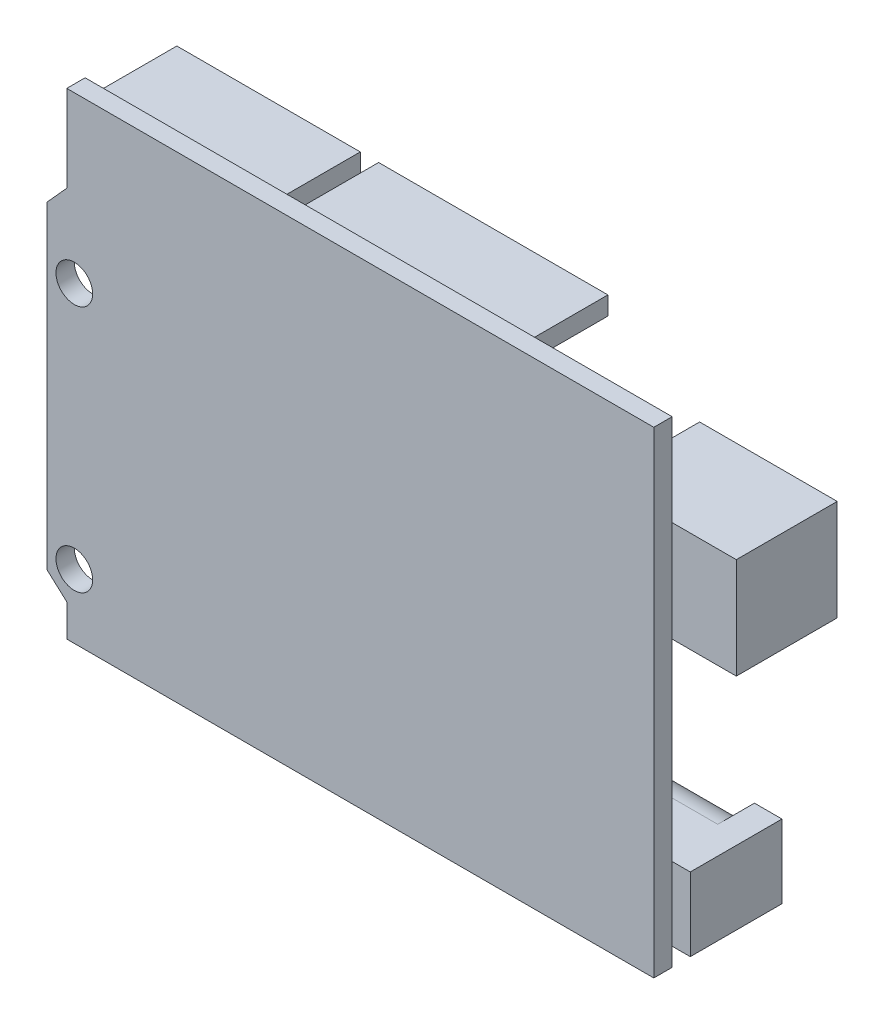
SolidWorks part; units mm, degrees
ref_plane "Plan de face" through (0, 0, 0) normal (0, 0, 1) x (1, 0, 0)
ref_plane "Plan de dessus" through (0, 0, 0) normal (0, 1, 0) x (1, 0, 0)
ref_plane "Plan de droite" through (0, 0, 0) normal (1, 0, 0) x (0, 0, -1)
sketch "Esquisse1" plane through (0, 0, 0) normal (0, 0, 1) x (1, 0, 0)
  line L1 (0, 0) -> (64, 0)
  line L2 (0, 0) -> (0, -52)
  line L3 (0, -52) -> (64, -52)
  line L4 (64, 0) -> (64, -52)
  dimension "D1" = 64
  dimension "D2" = 52
extrude "Boss.-Extru.1" add sketch "Esquisse1" along normal blind 2
sketch "Esquisse2" plane through (0, 0, 0) normal (0, 0, -1) x (-1, 0, 0)
  line L0 (-64, -52) -> (-64, 0) construction
  line L1 (-70.998, -10) -> (-55.998, -10)
  line L2 (-70.998, -10) -> (-70.998, -21)
  line L3 (-70.998, -21) -> (-55.998, -21)
  line L4 (-55.998, -10) -> (-55.998, -21)
  line L5 (-64, 0) -> (0, 0) construction
  dimension "D1" = 15
  dimension "D2" = 11
  dimension "D3" = 6.998
  dimension "D4" = 10
extrude "Boss.-Extru.2" add sketch "Esquisse2" along normal blind 11
sketch "Esquisse3" plane through (0, 0, 0) normal (0, 0, -1) x (-1, 0, 0)
  line L0 (-64, 0) -> (0, 0) construction
  line L1 (-21, -1) -> (-1, -1)
  line L2 (-21, -1) -> (-21, -3)
  line L3 (-21, -3) -> (-1, -3)
  line L4 (-1, -1) -> (-1, -3)
  line L5 (-23, -1) -> (-48, -1)
  line L6 (-23, -1) -> (-23, -3)
  line L7 (-23, -3) -> (-48, -3)
  line L8 (-48, -1) -> (-48, -3)
  line L9 (0, 0) -> (0, -52) construction
  line L10 (0, -52) -> (-64, -52) construction
  line L11 (-16, -49) -> (-1, -49)
  line L12 (-16, -49) -> (-16, -51)
  line L13 (-16, -51) -> (-1, -51)
  line L14 (-1, -49) -> (-1, -51)
  line L16 (-18, -49) -> (-38, -49)
  line L17 (-18, -49) -> (-18, -51)
  line L18 (-18, -51) -> (-38, -51)
  line L19 (-38, -49) -> (-38, -51)
  dimension "D1" = 20
  dimension "D2" = 25
  dimension "D3" = 2
  dimension "D4" = 2
  dimension "D5" = 1
  dimension "D6" = 1
  dimension "D7" = 2
  dimension "D8" = 1
  dimension "D9" = 2
  dimension "D10" = 15
  dimension "D11" = 1
  dimension "D12" = 1
  dimension "D13" = 20
  dimension "D14" = 2
extrude "Boss.-Extru.3" add sketch "Esquisse3" along normal blind 9
sketch "Esquisse4" plane through (0, 0, 0) normal (0, 0, -1) x (-1, 0, 0)
  line L0 (0, -48.4792) -> (2.1783, -46.5145)
  line L1 (0, 0) -> (0, -52) construction
  line L2 (2.1783, -46.5145) -> (2.1783, -11.8421)
  line L3 (2.1783, -11.8421) -> (0, -9.4272)
  line L4 (0, -9.4272) -> (0, -48.4792)
extrude "Boss.-Extru.4" add sketch "Esquisse4" against normal blind 2
sketch "Esquisse5" plane through (0, 0, 0) normal (0, 0, -1) x (-1, 0, 0)
  line L0 (0, -52) -> (-64, -52) construction
  line L1 (2.1783, -46.5145) -> (2.1783, -11.8421) construction
  circle A0 centre (-0.8217, -18) radius 2
  circle A1 centre (-0.8217, -45) radius 2
  dimension "D1" = 4
  dimension "D2" = 4
  dimension "D3" = 27
  dimension "D4" = 7
  dimension "D5" = 3
  dimension "D6" = 3
extrude "Enlèv. mat.-Extru.1" cut sketch "Esquisse5" against normal blind 2
sketch "Esquisse6" plane through (0, 0, 0) normal (0, 0, -1) x (-1, 0, 0)
  line L0 (0, -52) -> (-64, -52) construction
  line L1 (-65.9768, -42) -> (-52.9768, -42)
  line L2 (-65.9768, -42) -> (-65.9768, -50)
  line L3 (-65.9768, -50) -> (-52.9768, -50)
  line L4 (-52.9768, -42) -> (-52.9768, -50)
  dimension "D1" = 2
  dimension "D2" = 8
  dimension "D3" = 13
extrude "Boss.-Extru.5" add sketch "Esquisse6" along normal blind 10
sketch "Esquisse7" plane through (52.9768, 0, 0) normal (-1, 0, 0) x (0, 0, 1)
  line L0 (-10, -50) -> (-10, -42) construction
  line L1 (-6, -42) -> (-6.6743, -38.7629)
  line L2 (-6.6743, -38.7629) -> (-18.3715, -48.2716)
  line L3 (-18.3715, -48.2716) -> (-13.2398, -51.4412)
  line L4 (-13.2398, -51.4412) -> (-6, -50)
  arc A0 (-6, -42) -> (-6, -50) centre (-6, -46) ccw
  dimension "D1" = 8
  dimension "D2" = 4
extrude "Enlèv. mat.-Extru.2" cut sketch "Esquisse7" against normal blind 10
